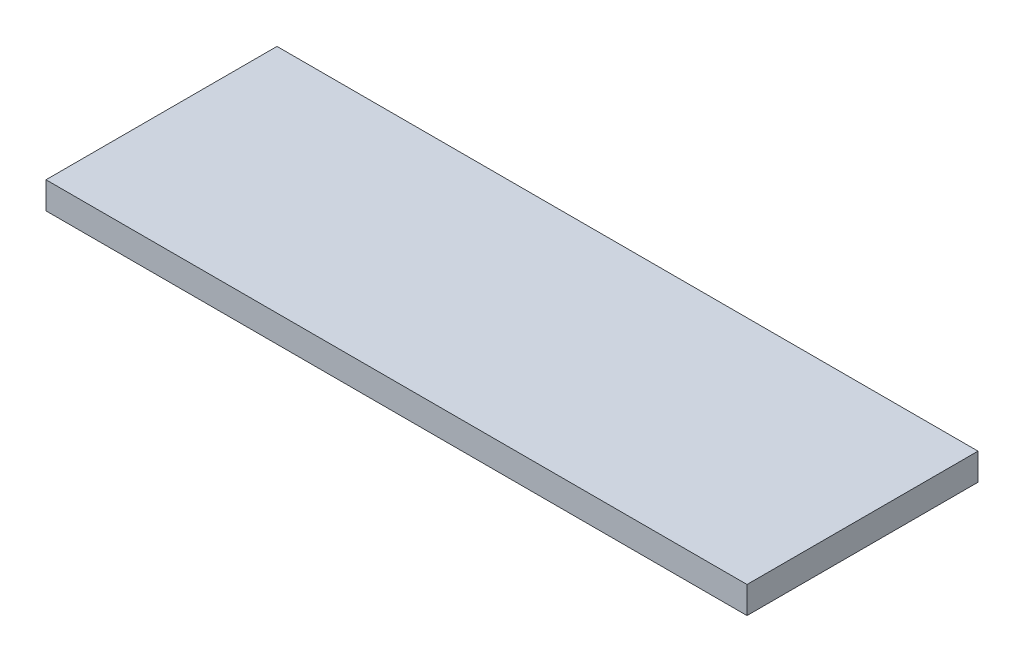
SolidWorks part; units mm, degrees
ref_plane "Front Plane" through (0, 0, 0) normal (0, 0, 1) x (1, 0, 0)
ref_plane "Top Plane" through (0, 0, 0) normal (0, 1, 0) x (1, 0, 0)
ref_plane "Right Plane" through (0, 0, 0) normal (1, 0, 0) x (0, 0, -1)
sketch "Sketch1" plane through (0, 0, 0) normal (0, 1, 0) x (1, 0, 0)
  line L1 (0, 0) -> (165.1, 0)
  line L2 (0, 0) -> (0, 54.4)
  line L3 (0, 54.4) -> (165.1, 54.4)
  line L4 (165.1, 0) -> (165.1, 54.4)
  point P5 (80.7707, 54.4)
  dimension "D1" = 54.4
  dimension "D2" = 165.1
extrude "Boss-Extrude1" add sketch "Sketch1" along normal blind 6.35
